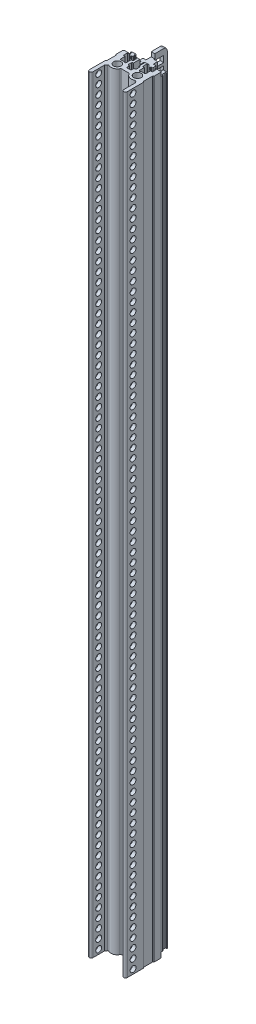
SolidWorks part; units mm, degrees
ref_plane "前视基准面" through (0, 0, 0) normal (0, 0, 1) x (1, 0, 0)
ref_plane "上视基准面" through (0, 0, 0) normal (0, 1, 0) x (1, 0, 0)
ref_plane "右视基准面" through (0, 0, 0) normal (1, 0, 0) x (0, 0, -1)
sketch "草图1" plane through (0, 0, 0) normal (0, 1, 0) x (1, 0, 0)
  line L0 (-2.825, 13.6) -> (-3.725, 13.6)
  line L1 (-8.025, 13.6) -> (-8.025, 11.3)
  line L2 (-3.725, 11.3) -> (-2.825, 11.3)
  line L3 (-3.725, 7.5298) -> (-3.725, 11.3)
  line L4 (-7.125, 11.3) -> (-7.125, 7.8763)
  line L5 (-8.025, 11.3) -> (-7.125, 11.3)
  line L6 (-2.825, 13.6) -> (-2.825, 11.3)
  line L7 (-7.125, 13.6) -> (-8.025, 13.6)
  line L8 (-7.125, 14.6) -> (-7.125, 13.6)
  line L9 (-8.025, 14.6) -> (-7.125, 14.6)
  line L10 (-8.025, 15.8) -> (-8.025, 14.6)
  line L11 (-7.125, 15.8) -> (-8.025, 15.8)
  line L12 (-5.675, 5.25) -> (5.675, 5.25) construction
  line L13 (0, 5.25) -> (0, 10.7319) construction
  line L15 (-10.275, 14.8) -> (-10.275, 13.75)
  line L16 (-9.525, 16.95) -> (-9.525, 15.2)
  line L17 (-10.275, 12.95) -> (-10.375, 12.95) construction
  line L18 (-10.675, 12.65) -> (-10.375, 12.95) construction
  line L19 (-10.675, 9.65) -> (-10.675, 12.65)
  line L20 (-10.2249, 9.1498) -> (-10.675, 9.65)
  line L21 (-10.2249, 9.1498) -> (-10.2251, 4.1498)
  line L22 (-10.675, 3.65) -> (-10.2251, 4.1498)
  line L23 (-10.675, -5.5) -> (-10.675, 3.65)
  line L24 (-8.675, -4.1) -> (-8.675, 0)
  line L25 (-0.675, 20.25) -> (-0.675, 17.75)
  line L26 (-2.075, 20.25) -> (-0.675, 20.25)
  line L27 (-2.075, 17.75) -> (-2.075, 20.25)
  line L28 (-3.725, 17.75) -> (-2.075, 17.75)
  line L29 (-3.725, 15.8) -> (-3.725, 17.75)
  line L30 (-2.825, 15.8) -> (-3.725, 15.8)
  line L31 (-2.825, 14.6) -> (-2.825, 15.8)
  line L32 (-3.725, 14.6) -> (-2.825, 14.6)
  line L33 (-3.725, 13.6) -> (-3.725, 14.6)
  line L34 (-10.675, -5.5) -> (-10.675, 3.65)
  line L35 (-8.675, -5.5) -> (-8.675, 0)
  line L36 (-0.675, 20.25) -> (-0.675, 17.75)
  line L37 (0.675, 20.25) -> (0.675, 17.75)
  line L38 (-2.075, 20.25) -> (-0.675, 20.25)
  line L39 (-2.075, 17.75) -> (-2.075, 20.25)
  line L40 (-3.725, 17.75) -> (-2.075, 17.75)
  line L41 (-3.725, 15.8) -> (-3.725, 17.75)
  line L42 (-2.825, 15.8) -> (-3.725, 15.8)
  line L43 (-2.825, 14.6) -> (-2.825, 15.8)
  line L44 (-3.725, 14.6) -> (-2.825, 14.6)
  line L45 (-3.725, 13.6) -> (-3.725, 14.6)
  line L46 (-2.825, 13.6) -> (-3.725, 13.6)
  line L47 (2.825, 13.6) -> (2.825, 11.3)
  line L48 (-3.725, 11.3) -> (-2.825, 11.3)
  line L49 (-3.725, 7.5298) -> (-3.725, 11.3)
  line L50 (-7.125, 11.3) -> (-7.125, 7.8763)
  line L51 (-8.025, 11.3) -> (-7.125, 11.3)
  line L52 (2.825, 11.3) -> (2.8554, 11.3157)
  line L53 (-7.125, 13.6) -> (-8.025, 13.6)
  line L54 (-7.125, 14.6) -> (-7.125, 13.6)
  line L55 (-8.025, 14.6) -> (-7.125, 14.6)
  line L56 (-8.025, 15.8) -> (-8.025, 14.6)
  line L57 (-7.125, 15.8) -> (-8.025, 15.8)
  line L58 (-10.275, 13.75) -> (-10.375, 13.75)
  line L59 (-9.725, 15) -> (-10.075, 15)
  line L60 (-7.875, 17.75) -> (-9.675, 17.75)
  line L61 (-9.675, 17.75) -> (-9.7164, 17.7086)
  line L62 (-10.225, 17.45) -> (-10.225, 17.35)
  line L63 (-10.275, 12.95) -> (-10.375, 12.95) construction
  line L64 (-10.675, 12.65) -> (-10.375, 12.95) construction
  line L65 (-10.675, 9.65) -> (-10.675, 12.65)
  line L66 (-10.2249, 9.1498) -> (-10.675, 9.65)
  line L67 (-10.2249, 9.1498) -> (-10.2251, 4.1498)
  line L68 (-10.2251, 4.1498) -> (-10.2251, 6.4588)
  line L69 (2.825, 13.6) -> (3.725, 13.6)
  line L70 (8.025, 13.6) -> (8.025, 11.3)
  line L71 (3.725, 11.3) -> (2.825, 11.3)
  line L72 (3.725, 7.5298) -> (3.725, 11.3)
  line L73 (7.125, 11.3) -> (7.125, 7.8763)
  line L74 (8.025, 11.3) -> (7.125, 11.3)
  line L75 (-10.025, 17.15) -> (-9.725, 17.15)
  line L76 (7.125, 13.6) -> (8.025, 13.6)
  line L77 (7.125, 14.6) -> (7.125, 13.6)
  line L78 (8.025, 14.6) -> (7.125, 14.6)
  line L79 (8.025, 15.8) -> (8.025, 14.6)
  line L80 (7.125, 15.8) -> (8.025, 15.8)
  line L81 (-9.8578, 17.65) -> (-10.025, 17.65)
  line L82 (-7.8336, 17.7086) -> (-7.875, 17.75)
  line L83 (-7.325, 17.35) -> (-7.325, 17.45)
  line L85 (7.125, 15.8) -> (7.125, 15.8672)
  line L86 (10.275, 12.95) -> (10.375, 12.95) construction
  line L87 (10.675, 12.65) -> (10.375, 12.95) construction
  line L88 (10.675, 9.65) -> (10.675, 12.65)
  line L89 (10.2249, 9.1498) -> (10.675, 9.65)
  line L90 (10.2249, 9.1498) -> (10.2251, 4.1498)
  line L91 (10.675, 3.65) -> (10.2251, 4.1498)
  line L92 (10.675, -5.5) -> (10.675, 3.65)
  line L93 (8.675, -4.1) -> (8.675, 0)
  line L94 (0.675, 20.25) -> (0.675, 17.75)
  line L95 (2.075, 20.25) -> (0.675, 20.25)
  line L96 (2.075, 17.75) -> (2.075, 20.25)
  line L97 (3.725, 17.75) -> (2.075, 17.75)
  line L98 (3.725, 15.8) -> (3.725, 17.75)
  line L99 (2.825, 15.8) -> (3.725, 15.8)
  line L100 (2.825, 14.6) -> (2.825, 15.8)
  line L101 (3.725, 14.6) -> (2.825, 14.6)
  line L102 (3.725, 13.6) -> (3.725, 14.6)
  line L103 (10.675, -5.5) -> (10.675, 3.65)
  line L104 (8.675, -5.5) -> (8.675, 0)
  line L105 (8.675, 0) -> (-8.675, 0)
  line L106 (0.675, 20.25) -> (0.675, 17.75)
  line L107 (2.075, 20.25) -> (0.675, 20.25)
  line L108 (2.075, 17.75) -> (2.075, 20.25)
  line L109 (3.725, 17.75) -> (2.075, 17.75)
  line L110 (3.725, 15.8) -> (3.725, 17.75)
  line L111 (2.825, 15.8) -> (3.725, 15.8)
  line L112 (2.825, 14.6) -> (2.825, 15.8)
  line L113 (3.725, 14.6) -> (2.825, 14.6)
  line L114 (3.725, 13.6) -> (3.725, 14.6)
  line L115 (2.825, 13.6) -> (3.725, 13.6)
  line L116 (7.1836, 16.0086) -> (7.7664, 16.5914)
  line L117 (3.725, 11.3) -> (2.825, 11.3)
  line L118 (3.725, 7.5298) -> (3.725, 11.3)
  line L119 (7.125, 11.3) -> (7.125, 7.8763)
  line L120 (8.025, 11.3) -> (7.125, 11.3)
  line L121 (7.825, 16.7328) -> (7.825, 16.95)
  line L122 (7.125, 13.6) -> (8.025, 13.6)
  line L123 (7.125, 14.6) -> (7.125, 13.6)
  line L124 (8.025, 14.6) -> (7.125, 14.6)
  line L125 (8.025, 15.8) -> (8.025, 14.6)
  line L126 (7.125, 15.8) -> (8.025, 15.8)
  line L127 (7.625, 17.15) -> (7.525, 17.15)
  line L128 (7.325, 17.35) -> (7.325, 17.45)
  line L129 (7.525, 17.65) -> (7.6922, 17.65)
  line L130 (7.8336, 17.7086) -> (7.875, 17.75)
  line L131 (9.725, 15) -> (10.075, 15)
  line L132 (10.275, 12.95) -> (10.375, 12.95) construction
  line L133 (10.675, 12.65) -> (10.375, 12.95) construction
  line L134 (10.675, 9.65) -> (10.675, 12.65)
  line L135 (10.2249, 9.1498) -> (10.675, 9.65)
  line L136 (10.2249, 9.1498) -> (10.2251, 4.1498)
  line L137 (10.2251, 4.1498) -> (10.2251, 6.4588)
  line L138 (-0.675, 17.75) -> (0.675, 17.75)
  line L139 (-7.125, 16.775) -> (-3.725, 16.775) construction
  line L140 (-5.425, 16.775) -> (-5.425, 11.3) construction
  line L141 (3.725, 16.775) -> (7.125, 16.775) construction
  line L142 (5.425, 16.775) -> (5.425, 12.65) construction
  line L143 (9.8578, 17.65) -> (10.025, 17.65)
  line L144 (10.025, 17.15) -> (9.725, 17.15)
  line L145 (10.225, 17.45) -> (10.225, 17.35)
  line L146 (9.675, 17.75) -> (9.7164, 17.7086)
  line L147 (9.525, 16.95) -> (9.525, 15.2)
  line L148 (7.875, 17.75) -> (9.675, 17.75)
  line L149 (10.275, 14.8) -> (10.275, 13.75)
  line L150 (-7.825, 16.7328) -> (-7.825, 16.95)
  line L151 (-7.125, 15.8) -> (-7.125, 15.8672)
  line L152 (-7.525, 17.65) -> (-7.6922, 17.65)
  line L153 (-7.625, 17.15) -> (-7.525, 17.15)
  line L154 (-7.1836, 16.0086) -> (-7.7664, 16.5914)
  line L155 (-10.375, 13.75) -> (-10.675, 13.45)
  line L156 (-10.675, 13.45) -> (-10.675, 12.65)
  line L157 (10.675, 13.45) -> (10.675, 12.65)
  line L158 (10.375, 13.75) -> (10.675, 13.45)
  line L159 (10.275, 13.75) -> (10.375, 13.75)
  arc A1 (-10.675, -5.5) -> (-8.675, -5.5) centre (-9.675, -5.5) ccw
  arc A2 (-10.675, -5.5) -> (-8.675, -5.5) centre (-9.675, -5.5) ccw
  circle A4 centre (-5.675, 5.25) radius 1.6
  arc A6 (8.675, -5.5) -> (10.675, -5.5) centre (9.675, -5.5) ccw
  arc A7 (8.675, -5.5) -> (10.675, -5.5) centre (9.675, -5.5) ccw
  circle A9 centre (5.675, 5.25) radius 1.6
  arc A10 (7.1836, 16.0086) -> (7.125, 15.8672) centre (7.325, 15.8672) ccw
  arc A11 (7.7664, 16.5914) -> (7.825, 16.7328) centre (7.625, 16.7328) ccw
  arc A12 (7.825, 16.95) -> (7.625, 17.15) centre (7.625, 16.95) ccw
  arc A13 (7.325, 17.35) -> (7.525, 17.15) centre (7.525, 17.35) ccw
  arc A14 (7.525, 17.65) -> (7.325, 17.45) centre (7.525, 17.45) ccw
  arc A15 (10.275, 14.8) -> (10.075, 15) centre (10.075, 14.8) ccw
  arc A16 (10.225, 17.45) -> (10.025, 17.65) centre (10.025, 17.45) ccw
  arc A17 (9.725, 17.15) -> (9.525, 16.95) centre (9.725, 16.95) ccw
  arc A18 (10.025, 17.15) -> (10.225, 17.35) centre (10.025, 17.35) ccw
  arc A19 (9.7164, 17.7086) -> (9.8578, 17.65) centre (9.8578, 17.85) ccw
  arc A20 (9.525, 15.2) -> (9.725, 15) centre (9.725, 15.2) ccw
  arc A21 (7.6922, 17.65) -> (7.8336, 17.7086) centre (7.6922, 17.85) ccw
  arc A22 (-9.525, 15.2) -> (-9.725, 15) centre (-9.725, 15.2) cw
  arc A23 (-10.275, 14.8) -> (-10.075, 15) centre (-10.075, 14.8) cw
  arc A24 (-9.7164, 17.7086) -> (-9.8578, 17.65) centre (-9.8578, 17.85) cw
  arc A25 (-10.025, 17.15) -> (-10.225, 17.35) centre (-10.025, 17.35) cw
  arc A26 (-9.725, 17.15) -> (-9.525, 16.95) centre (-9.725, 16.95) cw
  arc A27 (-10.225, 17.45) -> (-10.025, 17.65) centre (-10.025, 17.45) cw
  arc A28 (-7.7664, 16.5914) -> (-7.825, 16.7328) centre (-7.625, 16.7328) cw
  arc A29 (-7.1836, 16.0086) -> (-7.125, 15.8672) centre (-7.325, 15.8672) cw
  arc A30 (-7.6922, 17.65) -> (-7.8336, 17.7086) centre (-7.6922, 17.85) cw
  arc A31 (-7.525, 17.65) -> (-7.325, 17.45) centre (-7.525, 17.45) cw
  arc A32 (-7.325, 17.35) -> (-7.525, 17.15) centre (-7.525, 17.35) cw
  arc A33 (-7.825, 16.95) -> (-7.625, 17.15) centre (-7.625, 16.95) cw
  arc A34 (-3.725, 7.5298) -> (-7.125, 7.8763) centre (-5.675, 5.25) ccw
  arc A35 (7.125, 7.8763) -> (3.725, 7.5298) centre (5.675, 5.25) ccw
  dimension "D4" = 11.35
  dimension "D5" = 3.2
  dimension "D6" = 6
  dimension "D7" = 0.1
  dimension "D1" = 5.2
  dimension "D2" = 5.2
  dimension "D3" = 15
  dimension "D8" = 0.8
extrude "凸台-拉伸1" add sketch "草图1" along normal mid plane 431.8
sketch "草图4" plane through (0, 215.9, 0) normal (0, 1, 0) x (1, 0, 0)
  line L1 (-2.075, 17.75) -> (-0.075, 17.75)
  line L2 (-2.075, 17.75) -> (-2.075, 27.75)
  line L3 (-2.075, 27.75) -> (-0.075, 27.75)
  line L4 (-0.075, 17.75) -> (-0.075, 27.75)
  dimension "D1" = 2
  dimension "D2" = 10
extrude "凸台-拉伸2" add sketch "草图4" against normal up to surface (431.8 mm away)
sketch "草图17" plane through (0, 215.9, 0) normal (0, 1, 0) x (1, 0, 0)
  line L0 (7.125, 13.6) -> (8.025, 13.6) construction
  line L1 (8.125, 13.6) -> (2.725, 13.6)
  line L2 (8.125, 13.6) -> (8.125, 11.1)
  line L3 (8.125, 11.1) -> (2.725, 11.1)
  line L4 (2.725, 13.6) -> (2.725, 11.1)
  line L5 (7.125, 15.8) -> (8.025, 15.8) construction
  line L6 (8.125, 15.8) -> (2.725, 15.8)
  line L7 (8.125, 15.8) -> (8.125, 14.6)
  line L8 (8.125, 14.6) -> (2.725, 14.6)
  line L9 (2.725, 15.8) -> (2.725, 14.6)
  line L10 (3.725, 14.6) -> (2.825, 14.6) construction
  line L11 (-2.825, 15.8) -> (-3.725, 15.8) construction
  line L12 (-2.725, 15.8) -> (-8.125, 15.8)
  line L13 (-2.725, 15.8) -> (-2.725, 14.6)
  line L14 (-2.725, 14.6) -> (-8.125, 14.6)
  line L15 (-8.125, 15.8) -> (-8.125, 14.6)
  line L16 (-8.025, 14.6) -> (-7.125, 14.6) construction
  line L17 (-2.825, 13.6) -> (-3.725, 13.6) construction
  line L18 (-2.725, 13.6) -> (-8.125, 13.6)
  line L19 (-2.725, 13.6) -> (-2.725, 11.1)
  line L20 (-2.725, 11.1) -> (-8.125, 11.1)
  line L21 (-8.125, 13.6) -> (-8.125, 11.1)
  line L22 (8.025, 13.6) -> (8.025, 11.3) construction
  line L23 (2.825, 13.6) -> (2.825, 11.3) construction
  line L24 (3.725, 11.3) -> (2.825, 11.3) construction
  line L25 (-2.825, 13.6) -> (-2.825, 11.3) construction
  line L26 (-8.025, 13.6) -> (-8.025, 11.3) construction
  dimension "D1" = 0.1
  dimension "D2" = 0.1
  dimension "D3" = 0.2
  dimension "D4" = 0.1
  dimension "D5" = 0.1
extrude "切除-拉伸10" cut sketch "草图17" against normal through all
fillet "圆角4" radius 0.2 16 edges at (8.125, 0, -11.1) (8.125, 0, -14.6) (8.125, 0, -13.6) (8.125, 0, -15.8) (2.725, 0, -15.8) (2.725, 0, -13.6) (2.725, 0, -11.1) (2.725, 0, -14.6) (-8.125, 0, -11.1) (-8.125, 0, -14.6) (-8.125, 0, -13.6) (-8.125, 0, -15.8) (-2.725, 0, -11.1) (-2.725, 0, -14.6) (-2.725, 0, -13.6) (-2.725, 0, -15.8)
sketch "草图14" plane through (0, 215.9, 0) normal (0, 1, 0) x (1, 0, 0)
  line L0 (-0.075, 17.75) -> (-0.575, 17.75)
  line L1 (-0.575, 17.75) -> (-0.575, 19.25)
  line L2 (-0.575, 19.25) -> (-0.075, 19.75)
  line L3 (-0.075, 17.75) -> (-0.075, 27.75) construction
  line L4 (-0.075, 19.75) -> (-0.075, 17.75)
  line L5 (0.675, 20.25) -> (1.675, 20.25)
  line L6 (2.075, 20.25) -> (0.675, 20.25) construction
  line L7 (1.675, 20.25) -> (0.675, 19.25)
  line L8 (0.675, 20.25) -> (0.675, 17.75) construction
  line L9 (0.675, 19.25) -> (0.675, 20.25)
  dimension "D1" = 45
  dimension "D2" = 0.5
  dimension "D3" = 0.5
  dimension "D4" = 1
  dimension "D5" = 1
extrude "切除-拉伸7" cut sketch "草图14" against normal through all
sketch "草图19" plane through (0, 215.9, 0) normal (0, 1, 0) x (1, 0, 0)
  line L1 (2.075, 20.25) -> (-0.575, 20.25)
  line L2 (2.075, 20.25) -> (2.075, 17.75)
  line L3 (2.075, 17.75) -> (-0.575, 17.75)
  line L4 (-0.575, 20.25) -> (-0.575, 17.75)
extrude "凸台-拉伸3" add sketch "草图19" against normal up to surface (431.8 mm away)
sketch "草图6" plane through (0, -215.9, 0) normal (0, -1, 0) x (-1, 0, 0)
  line L0 (0, 0) -> (0, 12.9416) construction
  line L1 (8.675, 0) -> (8.675, 1)
  line L2 (-7.6934, 2.3906) -> (-8.675, 1)
  line L3 (7.6934, 2.3906) -> (8.675, 1)
  line L4 (-8.675, 0) -> (-8.675, 1)
  line L5 (-3.725, 17.75) -> (-2.075, 17.75) construction
  line L7 (2.25, 7.75) -> (2.25, 10.25)
  line L8 (8.675, 0) -> (-8.675, 0)
  line L9 (8.675, -5.5) -> (8.675, 0) construction
  line L10 (-2.4058, 4) -> (2.4058, 4)
  line L11 (2.25, 10.25) -> (1.5, 10.25)
  line L12 (1.5, 10.25) -> (1.5, 16.25)
  line L13 (-1.5, 10.25) -> (-1.5, 16.25)
  line L14 (-2.25, 10.25) -> (-1.5, 10.25)
  line L15 (-2.25, 7.75) -> (-2.25, 10.25)
  line L16 (2.25, 7.75) -> (1.25, 7.75)
  line L17 (1.25, 7.75) -> (1.25, 6)
  line L18 (-1.25, 7.75) -> (-1.25, 6)
  line L19 (-2.25, 7.75) -> (-1.25, 7.75)
  line L20 (1.25, 6) -> (-1.25, 6)
  line L21 (1.5, 16.25) -> (-1.5, 16.25)
  arc A0 (2.4058, 4) -> (7.6934, 2.3906) centre (5.675, 5.25) ccw
  arc A1 (-2.4058, 4) -> (-7.6934, 2.3906) centre (-5.675, 5.25) cw
  dimension "D1" = 7
  dimension "D3" = 4
  dimension "D2" = 1
  dimension "D4" = 1.5
  dimension "D6" = 2
  dimension "D7" = 2.5
  dimension "D8" = 3
  dimension "D9" = 4.5
  dimension "D10" = 6
  dimension "D11" = 2.5
extrude "切除-拉伸4" cut sketch "草图6" against normal through all
sketch "草图2" plane through (10.675, 0, 0) normal (1, 0, 0) x (0, 0, -1)
  line L0 (20.25, 0) -> (52.8609, 0) construction
  line L1 (20.75, 215.9) -> (13.75, 215.9)
  line L2 (20.75, 215.9) -> (20.75, 213.36)
  line L3 (20.75, 213.36) -> (13.75, 213.36)
  line L4 (13.75, 215.9) -> (13.75, 213.36)
  line L5 (20.25, 215.9) -> (20.25, -215.9) construction
  line L6 (13.75, -215.9) -> (13.75, -213.36)
  line L7 (20.75, -213.36) -> (13.75, -213.36)
  line L8 (20.75, -215.9) -> (20.75, -213.36)
  line L9 (20.75, -215.9) -> (13.75, -215.9)
  line L11 (17.75, 215.9) -> (27.75, 215.9) construction
  line L12 (27.75, -215.9) -> (27.75, 215.9) construction
  dimension "D1" = 7
  dimension "D2" = 2.54
  dimension "D3" = 7
extrude "切除-拉伸1" cut sketch "草图2" against normal through all
sketch "草图3" plane through (10.675, 0, 0) normal (1, 0, 0) x (0, 0, -1)
  line L0 (-6.5, 215.9) -> (-6.5, -215.9) construction
  line L1 (-5.5, 215.9) -> (3.65, 215.9) construction
  circle A0 centre (-2.25, 213.36) radius 1.65
  circle A1 centre (-2.25, 208.28) radius 1.65
  circle A2 centre (-2.25, 203.2) radius 1.65
  circle A3 centre (-2.25, 198.12) radius 1.65
  circle A4 centre (-2.25, 193.04) radius 1.65
  circle A5 centre (-2.25, 187.96) radius 1.65
  circle A6 centre (-2.25, 182.88) radius 1.65
  circle A7 centre (-2.25, 177.8) radius 1.65
  circle A8 centre (-2.25, 172.72) radius 1.65
  circle A9 centre (-2.25, 167.64) radius 1.65
  circle A10 centre (-2.25, 162.56) radius 1.65
  circle A11 centre (-2.25, 157.48) radius 1.65
  circle A12 centre (-2.25, 152.4) radius 1.65
  circle A13 centre (-2.25, 147.32) radius 1.65
  circle A14 centre (-2.25, 142.24) radius 1.65
  circle A15 centre (-2.25, 137.16) radius 1.65
  circle A16 centre (-2.25, 132.08) radius 1.65
  circle A17 centre (-2.25, 127) radius 1.65
  circle A18 centre (-2.25, 121.92) radius 1.65
  circle A19 centre (-2.25, 116.84) radius 1.65
  circle A20 centre (-2.25, 111.76) radius 1.65
  circle A21 centre (-2.25, 106.68) radius 1.65
  circle A22 centre (-2.25, 101.6) radius 1.65
  circle A23 centre (-2.25, 96.52) radius 1.65
  circle A24 centre (-2.25, 91.44) radius 1.65
  circle A25 centre (-2.25, 86.36) radius 1.65
  circle A26 centre (-2.25, 81.28) radius 1.65
  circle A27 centre (-2.25, 76.2) radius 1.65
  circle A28 centre (-2.25, 71.12) radius 1.65
  circle A29 centre (-2.25, 66.04) radius 1.65
  circle A30 centre (-2.25, 60.96) radius 1.65
  circle A31 centre (-2.25, 55.88) radius 1.65
  circle A32 centre (-2.25, 50.8) radius 1.65
  circle A33 centre (-2.25, 45.72) radius 1.65
  circle A34 centre (-2.25, 40.64) radius 1.65
  circle A35 centre (-2.25, 35.56) radius 1.65
  circle A36 centre (-2.25, 30.48) radius 1.65
  circle A37 centre (-2.25, 25.4) radius 1.65
  circle A38 centre (-2.25, 20.32) radius 1.65
  circle A39 centre (-2.25, 15.24) radius 1.65
  circle A40 centre (-2.25, 10.16) radius 1.65
  circle A41 centre (-2.25, 5.08) radius 1.65
  circle A42 centre (-2.25, 0) radius 1.65
  circle A43 centre (-2.25, -5.08) radius 1.65
  circle A44 centre (-2.25, -10.16) radius 1.65
  circle A45 centre (-2.25, -15.24) radius 1.65
  circle A46 centre (-2.25, -20.32) radius 1.65
  circle A47 centre (-2.25, -25.4) radius 1.65
  circle A48 centre (-2.25, -30.48) radius 1.65
  circle A49 centre (-2.25, -35.56) radius 1.65
  circle A50 centre (-2.25, -40.64) radius 1.65
  circle A51 centre (-2.25, -45.72) radius 1.65
  circle A52 centre (-2.25, -50.8) radius 1.65
  circle A53 centre (-2.25, -55.88) radius 1.65
  circle A54 centre (-2.25, -60.96) radius 1.65
  circle A55 centre (-2.25, -66.04) radius 1.65
  circle A56 centre (-2.25, -71.12) radius 1.65
  circle A57 centre (-2.25, -76.2) radius 1.65
  circle A58 centre (-2.25, -81.28) radius 1.65
  circle A59 centre (-2.25, -86.36) radius 1.65
  circle A60 centre (-2.25, -91.44) radius 1.65
  circle A61 centre (-2.25, -96.52) radius 1.65
  circle A62 centre (-2.25, -101.6) radius 1.65
  circle A63 centre (-2.25, -106.68) radius 1.65
  circle A64 centre (-2.25, -111.76) radius 1.65
  circle A65 centre (-2.25, -116.84) radius 1.65
  circle A66 centre (-2.25, -121.92) radius 1.65
  circle A67 centre (-2.25, -127) radius 1.65
  circle A68 centre (-2.25, -132.08) radius 1.65
  circle A69 centre (-2.25, -137.16) radius 1.65
  circle A70 centre (-2.25, -142.24) radius 1.65
  circle A71 centre (-2.25, -147.32) radius 1.65
  circle A72 centre (-2.25, -152.4) radius 1.65
  circle A73 centre (-2.25, -157.48) radius 1.65
  circle A74 centre (-2.25, -162.56) radius 1.65
  circle A75 centre (-2.25, -167.64) radius 1.65
  circle A76 centre (-2.25, -172.72) radius 1.65
  circle A77 centre (-2.25, -177.8) radius 1.65
  circle A78 centre (-2.25, -182.88) radius 1.65
  circle A79 centre (-2.25, -187.96) radius 1.65
  circle A80 centre (-2.25, -193.04) radius 1.65
  circle A81 centre (-2.25, -198.12) radius 1.65
  circle A82 centre (-2.25, -203.2) radius 1.65
  circle A83 centre (-2.25, -208.28) radius 1.65
  circle A84 centre (-2.25, -213.36) radius 1.65
  dimension "D1" = 4.25
  dimension "D3" = 3.3
  dimension "D2" = 2.54
  dimension "D4" = 85
extrude "切除-拉伸2" cut sketch "草图3" against normal through all
sketch "草图5" plane through (-2.075, 0, 0) normal (-1, 0, 0) x (0, 0, 1)
  line L0 (-27.75, -215.9) -> (-27.75, 215.9) construction
  line L1 (-25.75, -209.02) -> (-20.25, -209.02)
  line L2 (-25.75, -209.02) -> (-25.75, -212.62)
  line L3 (-25.75, -212.62) -> (-20.25, -212.62)
  line L4 (-20.25, -209.02) -> (-20.25, -212.62)
  line L5 (-20.75, -215.9) -> (-27.75, -215.9) construction
  line L6 (-25.75, -203.94) -> (-20.25, -203.94)
  line L7 (-25.75, -203.94) -> (-25.75, -207.54)
  line L8 (-25.75, -207.54) -> (-20.25, -207.54)
  line L9 (-20.25, -203.94) -> (-20.25, -207.54)
  line L10 (-25.75, -198.86) -> (-20.25, -198.86)
  line L11 (-25.75, -198.86) -> (-25.75, -202.46)
  line L12 (-25.75, -202.46) -> (-20.25, -202.46)
  line L13 (-20.25, -198.86) -> (-20.25, -202.46)
  line L14 (-25.75, -193.78) -> (-20.25, -193.78)
  line L15 (-25.75, -193.78) -> (-25.75, -197.38)
  line L16 (-25.75, -197.38) -> (-20.25, -197.38)
  line L17 (-20.25, -193.78) -> (-20.25, -197.38)
  line L18 (-25.75, -188.7) -> (-20.25, -188.7)
  line L19 (-25.75, -188.7) -> (-25.75, -192.3)
  line L20 (-25.75, -192.3) -> (-20.25, -192.3)
  line L21 (-20.25, -188.7) -> (-20.25, -192.3)
  line L22 (-25.75, -183.62) -> (-20.25, -183.62)
  line L23 (-25.75, -183.62) -> (-25.75, -187.22)
  line L24 (-25.75, -187.22) -> (-20.25, -187.22)
  line L25 (-20.25, -183.62) -> (-20.25, -187.22)
  line L26 (-25.75, -178.54) -> (-20.25, -178.54)
  line L27 (-25.75, -178.54) -> (-25.75, -182.14)
  line L28 (-25.75, -182.14) -> (-20.25, -182.14)
  line L29 (-20.25, -178.54) -> (-20.25, -182.14)
  line L30 (-25.75, -173.46) -> (-20.25, -173.46)
  line L31 (-25.75, -173.46) -> (-25.75, -177.06)
  line L32 (-25.75, -177.06) -> (-20.25, -177.06)
  line L33 (-20.25, -173.46) -> (-20.25, -177.06)
  line L34 (-25.75, -168.38) -> (-20.25, -168.38)
  line L35 (-25.75, -168.38) -> (-25.75, -171.98)
  line L36 (-25.75, -171.98) -> (-20.25, -171.98)
  line L37 (-20.25, -168.38) -> (-20.25, -171.98)
  line L38 (-25.75, -163.3) -> (-20.25, -163.3)
  line L39 (-25.75, -163.3) -> (-25.75, -166.9)
  line L40 (-25.75, -166.9) -> (-20.25, -166.9)
  line L41 (-20.25, -163.3) -> (-20.25, -166.9)
  line L42 (-25.75, -158.22) -> (-20.25, -158.22)
  line L43 (-25.75, -158.22) -> (-25.75, -161.82)
  line L44 (-25.75, -161.82) -> (-20.25, -161.82)
  line L45 (-20.25, -158.22) -> (-20.25, -161.82)
  line L46 (-25.75, -153.14) -> (-20.25, -153.14)
  line L47 (-25.75, -153.14) -> (-25.75, -156.74)
  line L48 (-25.75, -156.74) -> (-20.25, -156.74)
  line L49 (-20.25, -153.14) -> (-20.25, -156.74)
  line L50 (-25.75, -148.06) -> (-20.25, -148.06)
  line L51 (-25.75, -148.06) -> (-25.75, -151.66)
  line L52 (-25.75, -151.66) -> (-20.25, -151.66)
  line L53 (-20.25, -148.06) -> (-20.25, -151.66)
  line L54 (-25.75, -142.98) -> (-20.25, -142.98)
  line L55 (-25.75, -142.98) -> (-25.75, -146.58)
  line L56 (-25.75, -146.58) -> (-20.25, -146.58)
  line L57 (-20.25, -142.98) -> (-20.25, -146.58)
  line L58 (-25.75, -137.9) -> (-20.25, -137.9)
  line L59 (-25.75, -137.9) -> (-25.75, -141.5)
  line L60 (-25.75, -141.5) -> (-20.25, -141.5)
  line L61 (-20.25, -137.9) -> (-20.25, -141.5)
  line L62 (-25.75, -132.82) -> (-20.25, -132.82)
  line L63 (-25.75, -132.82) -> (-25.75, -136.42)
  line L64 (-25.75, -136.42) -> (-20.25, -136.42)
  line L65 (-20.25, -132.82) -> (-20.25, -136.42)
  line L66 (-25.75, -127.74) -> (-20.25, -127.74)
  line L67 (-25.75, -127.74) -> (-25.75, -131.34)
  line L68 (-25.75, -131.34) -> (-20.25, -131.34)
  line L69 (-20.25, -127.74) -> (-20.25, -131.34)
  line L70 (-25.75, -122.66) -> (-20.25, -122.66)
  line L71 (-25.75, -122.66) -> (-25.75, -126.26)
  line L72 (-25.75, -126.26) -> (-20.25, -126.26)
  line L73 (-20.25, -122.66) -> (-20.25, -126.26)
  line L74 (-25.75, -117.58) -> (-20.25, -117.58)
  line L75 (-25.75, -117.58) -> (-25.75, -121.18)
  line L76 (-25.75, -121.18) -> (-20.25, -121.18)
  line L77 (-20.25, -117.58) -> (-20.25, -121.18)
  line L78 (-25.75, -112.5) -> (-20.25, -112.5)
  line L79 (-25.75, -112.5) -> (-25.75, -116.1)
  line L80 (-25.75, -116.1) -> (-20.25, -116.1)
  line L81 (-20.25, -112.5) -> (-20.25, -116.1)
  line L82 (-25.75, -107.42) -> (-20.25, -107.42)
  line L83 (-25.75, -107.42) -> (-25.75, -111.02)
  line L84 (-25.75, -111.02) -> (-20.25, -111.02)
  line L85 (-20.25, -107.42) -> (-20.25, -111.02)
  line L86 (-25.75, -102.34) -> (-20.25, -102.34)
  line L87 (-25.75, -102.34) -> (-25.75, -105.94)
  line L88 (-25.75, -105.94) -> (-20.25, -105.94)
  line L89 (-20.25, -102.34) -> (-20.25, -105.94)
  line L90 (-25.75, -97.26) -> (-20.25, -97.26)
  line L91 (-25.75, -97.26) -> (-25.75, -100.86)
  line L92 (-25.75, -100.86) -> (-20.25, -100.86)
  line L93 (-20.25, -97.26) -> (-20.25, -100.86)
  line L94 (-25.75, -92.18) -> (-20.25, -92.18)
  line L95 (-25.75, -92.18) -> (-25.75, -95.78)
  line L96 (-25.75, -95.78) -> (-20.25, -95.78)
  line L97 (-20.25, -92.18) -> (-20.25, -95.78)
  line L98 (-25.75, -87.1) -> (-20.25, -87.1)
  line L99 (-25.75, -87.1) -> (-25.75, -90.7)
  line L100 (-25.75, -90.7) -> (-20.25, -90.7)
  line L101 (-20.25, -87.1) -> (-20.25, -90.7)
  line L102 (-25.75, -82.02) -> (-20.25, -82.02)
  line L103 (-25.75, -82.02) -> (-25.75, -85.62)
  line L104 (-25.75, -85.62) -> (-20.25, -85.62)
  line L105 (-20.25, -82.02) -> (-20.25, -85.62)
  line L106 (-25.75, -76.94) -> (-20.25, -76.94)
  line L107 (-25.75, -76.94) -> (-25.75, -80.54)
  line L108 (-25.75, -80.54) -> (-20.25, -80.54)
  line L109 (-20.25, -76.94) -> (-20.25, -80.54)
  line L110 (-25.75, -71.86) -> (-20.25, -71.86)
  line L111 (-25.75, -71.86) -> (-25.75, -75.46)
  line L112 (-25.75, -75.46) -> (-20.25, -75.46)
  line L113 (-20.25, -71.86) -> (-20.25, -75.46)
  line L114 (-25.75, -66.78) -> (-20.25, -66.78)
  line L115 (-25.75, -66.78) -> (-25.75, -70.38)
  line L116 (-25.75, -70.38) -> (-20.25, -70.38)
  line L117 (-20.25, -66.78) -> (-20.25, -70.38)
  line L118 (-25.75, -61.7) -> (-20.25, -61.7)
  line L119 (-25.75, -61.7) -> (-25.75, -65.3)
  line L120 (-25.75, -65.3) -> (-20.25, -65.3)
  line L121 (-20.25, -61.7) -> (-20.25, -65.3)
  line L122 (-25.75, -56.62) -> (-20.25, -56.62)
  line L123 (-25.75, -56.62) -> (-25.75, -60.22)
  line L124 (-25.75, -60.22) -> (-20.25, -60.22)
  line L125 (-20.25, -56.62) -> (-20.25, -60.22)
  line L126 (-25.75, -51.54) -> (-20.25, -51.54)
  line L127 (-25.75, -51.54) -> (-25.75, -55.14)
  line L128 (-25.75, -55.14) -> (-20.25, -55.14)
  line L129 (-20.25, -51.54) -> (-20.25, -55.14)
  line L130 (-25.75, -46.46) -> (-20.25, -46.46)
  line L131 (-25.75, -46.46) -> (-25.75, -50.06)
  line L132 (-25.75, -50.06) -> (-20.25, -50.06)
  line L133 (-20.25, -46.46) -> (-20.25, -50.06)
  line L134 (-25.75, -41.38) -> (-20.25, -41.38)
  line L135 (-25.75, -41.38) -> (-25.75, -44.98)
  line L136 (-25.75, -44.98) -> (-20.25, -44.98)
  line L137 (-20.25, -41.38) -> (-20.25, -44.98)
  line L138 (-25.75, -36.3) -> (-20.25, -36.3)
  line L139 (-25.75, -36.3) -> (-25.75, -39.9)
  line L140 (-25.75, -39.9) -> (-20.25, -39.9)
  line L141 (-20.25, -36.3) -> (-20.25, -39.9)
  line L142 (-25.75, -31.22) -> (-20.25, -31.22)
  line L143 (-25.75, -31.22) -> (-25.75, -34.82)
  line L144 (-25.75, -34.82) -> (-20.25, -34.82)
  line L145 (-20.25, -31.22) -> (-20.25, -34.82)
  line L146 (-25.75, -26.14) -> (-20.25, -26.14)
  line L147 (-25.75, -26.14) -> (-25.75, -29.74)
  line L148 (-25.75, -29.74) -> (-20.25, -29.74)
  line L149 (-20.25, -26.14) -> (-20.25, -29.74)
  line L150 (-25.75, -21.06) -> (-20.25, -21.06)
  line L151 (-25.75, -21.06) -> (-25.75, -24.66)
  line L152 (-25.75, -24.66) -> (-20.25, -24.66)
  line L153 (-20.25, -21.06) -> (-20.25, -24.66)
  line L154 (-25.75, -15.98) -> (-20.25, -15.98)
  line L155 (-25.75, -15.98) -> (-25.75, -19.58)
  line L156 (-25.75, -19.58) -> (-20.25, -19.58)
  line L157 (-20.25, -15.98) -> (-20.25, -19.58)
  line L158 (-25.75, -10.9) -> (-20.25, -10.9)
  line L159 (-25.75, -10.9) -> (-25.75, -14.5)
  line L160 (-25.75, -14.5) -> (-20.25, -14.5)
  line L161 (-20.25, -10.9) -> (-20.25, -14.5)
  line L162 (-25.75, -5.82) -> (-20.25, -5.82)
  line L163 (-25.75, -5.82) -> (-25.75, -9.42)
  line L164 (-25.75, -9.42) -> (-20.25, -9.42)
  line L165 (-20.25, -5.82) -> (-20.25, -9.42)
  line L166 (-25.75, -0.74) -> (-20.25, -0.74)
  line L167 (-25.75, -0.74) -> (-25.75, -4.34)
  line L168 (-25.75, -4.34) -> (-20.25, -4.34)
  line L169 (-20.25, -0.74) -> (-20.25, -4.34)
  line L170 (-25.75, 4.34) -> (-20.25, 4.34)
  line L171 (-25.75, 4.34) -> (-25.75, 0.74)
  line L172 (-25.75, 0.74) -> (-20.25, 0.74)
  line L173 (-20.25, 4.34) -> (-20.25, 0.74)
  line L174 (-25.75, 9.42) -> (-20.25, 9.42)
  line L175 (-25.75, 9.42) -> (-25.75, 5.82)
  line L176 (-25.75, 5.82) -> (-20.25, 5.82)
  line L177 (-20.25, 9.42) -> (-20.25, 5.82)
  line L178 (-25.75, 14.5) -> (-20.25, 14.5)
  line L179 (-25.75, 14.5) -> (-25.75, 10.9)
  line L180 (-25.75, 10.9) -> (-20.25, 10.9)
  line L181 (-20.25, 14.5) -> (-20.25, 10.9)
  line L182 (-25.75, 19.58) -> (-20.25, 19.58)
  line L183 (-25.75, 19.58) -> (-25.75, 15.98)
  line L184 (-25.75, 15.98) -> (-20.25, 15.98)
  line L185 (-20.25, 19.58) -> (-20.25, 15.98)
  line L186 (-25.75, 24.66) -> (-20.25, 24.66)
  line L187 (-25.75, 24.66) -> (-25.75, 21.06)
  line L188 (-25.75, 21.06) -> (-20.25, 21.06)
  line L189 (-20.25, 24.66) -> (-20.25, 21.06)
  line L190 (-25.75, 29.74) -> (-20.25, 29.74)
  line L191 (-25.75, 29.74) -> (-25.75, 26.14)
  line L192 (-25.75, 26.14) -> (-20.25, 26.14)
  line L193 (-20.25, 29.74) -> (-20.25, 26.14)
  line L194 (-25.75, 34.82) -> (-20.25, 34.82)
  line L195 (-25.75, 34.82) -> (-25.75, 31.22)
  line L196 (-25.75, 31.22) -> (-20.25, 31.22)
  line L197 (-20.25, 34.82) -> (-20.25, 31.22)
  line L198 (-25.75, 39.9) -> (-20.25, 39.9)
  line L199 (-25.75, 39.9) -> (-25.75, 36.3)
  line L200 (-25.75, 36.3) -> (-20.25, 36.3)
  line L201 (-20.25, 39.9) -> (-20.25, 36.3)
  line L202 (-25.75, 44.98) -> (-20.25, 44.98)
  line L203 (-25.75, 44.98) -> (-25.75, 41.38)
  line L204 (-25.75, 41.38) -> (-20.25, 41.38)
  line L205 (-20.25, 44.98) -> (-20.25, 41.38)
  line L206 (-25.75, 50.06) -> (-20.25, 50.06)
  line L207 (-25.75, 50.06) -> (-25.75, 46.46)
  line L208 (-25.75, 46.46) -> (-20.25, 46.46)
  line L209 (-20.25, 50.06) -> (-20.25, 46.46)
  line L210 (-25.75, 55.14) -> (-20.25, 55.14)
  line L211 (-25.75, 55.14) -> (-25.75, 51.54)
  line L212 (-25.75, 51.54) -> (-20.25, 51.54)
  line L213 (-20.25, 55.14) -> (-20.25, 51.54)
  line L214 (-25.75, 60.22) -> (-20.25, 60.22)
  line L215 (-25.75, 60.22) -> (-25.75, 56.62)
  line L216 (-25.75, 56.62) -> (-20.25, 56.62)
  line L217 (-20.25, 60.22) -> (-20.25, 56.62)
  line L218 (-25.75, 65.3) -> (-20.25, 65.3)
  line L219 (-25.75, 65.3) -> (-25.75, 61.7)
  line L220 (-25.75, 61.7) -> (-20.25, 61.7)
  line L221 (-20.25, 65.3) -> (-20.25, 61.7)
  line L222 (-25.75, 70.38) -> (-20.25, 70.38)
  line L223 (-25.75, 70.38) -> (-25.75, 66.78)
  line L224 (-25.75, 66.78) -> (-20.25, 66.78)
  line L225 (-20.25, 70.38) -> (-20.25, 66.78)
  line L226 (-25.75, 75.46) -> (-20.25, 75.46)
  line L227 (-25.75, 75.46) -> (-25.75, 71.86)
  line L228 (-25.75, 71.86) -> (-20.25, 71.86)
  line L229 (-20.25, 75.46) -> (-20.25, 71.86)
  line L230 (-25.75, 80.54) -> (-20.25, 80.54)
  line L231 (-25.75, 80.54) -> (-25.75, 76.94)
  line L232 (-25.75, 76.94) -> (-20.25, 76.94)
  line L233 (-20.25, 80.54) -> (-20.25, 76.94)
  line L234 (-25.75, 85.62) -> (-20.25, 85.62)
  line L235 (-25.75, 85.62) -> (-25.75, 82.02)
  line L236 (-25.75, 82.02) -> (-20.25, 82.02)
  line L237 (-20.25, 85.62) -> (-20.25, 82.02)
  line L238 (-25.75, 90.7) -> (-20.25, 90.7)
  line L239 (-25.75, 90.7) -> (-25.75, 87.1)
  line L240 (-25.75, 87.1) -> (-20.25, 87.1)
  line L241 (-20.25, 90.7) -> (-20.25, 87.1)
  line L242 (-25.75, 95.78) -> (-20.25, 95.78)
  line L243 (-25.75, 95.78) -> (-25.75, 92.18)
  line L244 (-25.75, 92.18) -> (-20.25, 92.18)
  line L245 (-20.25, 95.78) -> (-20.25, 92.18)
  line L246 (-25.75, 100.86) -> (-20.25, 100.86)
  line L247 (-25.75, 100.86) -> (-25.75, 97.26)
  line L248 (-25.75, 97.26) -> (-20.25, 97.26)
  line L249 (-20.25, 100.86) -> (-20.25, 97.26)
  line L250 (-25.75, 105.94) -> (-20.25, 105.94)
  line L251 (-25.75, 105.94) -> (-25.75, 102.34)
  line L252 (-25.75, 102.34) -> (-20.25, 102.34)
  line L253 (-20.25, 105.94) -> (-20.25, 102.34)
  line L254 (-25.75, 111.02) -> (-20.25, 111.02)
  line L255 (-25.75, 111.02) -> (-25.75, 107.42)
  line L256 (-25.75, 107.42) -> (-20.25, 107.42)
  line L257 (-20.25, 111.02) -> (-20.25, 107.42)
  line L258 (-25.75, 116.1) -> (-20.25, 116.1)
  line L259 (-25.75, 116.1) -> (-25.75, 112.5)
  line L260 (-25.75, 112.5) -> (-20.25, 112.5)
  line L261 (-20.25, 116.1) -> (-20.25, 112.5)
  line L262 (-25.75, 121.18) -> (-20.25, 121.18)
  line L263 (-25.75, 121.18) -> (-25.75, 117.58)
  line L264 (-25.75, 117.58) -> (-20.25, 117.58)
  line L265 (-20.25, 121.18) -> (-20.25, 117.58)
  line L266 (-25.75, 126.26) -> (-20.25, 126.26)
  line L267 (-25.75, 126.26) -> (-25.75, 122.66)
  line L268 (-25.75, 122.66) -> (-20.25, 122.66)
  line L269 (-20.25, 126.26) -> (-20.25, 122.66)
  line L270 (-25.75, 131.34) -> (-20.25, 131.34)
  line L271 (-25.75, 131.34) -> (-25.75, 127.74)
  line L272 (-25.75, 127.74) -> (-20.25, 127.74)
  line L273 (-20.25, 131.34) -> (-20.25, 127.74)
  line L274 (-25.75, 136.42) -> (-20.25, 136.42)
  line L275 (-25.75, 136.42) -> (-25.75, 132.82)
  line L276 (-25.75, 132.82) -> (-20.25, 132.82)
  line L277 (-20.25, 136.42) -> (-20.25, 132.82)
  line L278 (-25.75, 141.5) -> (-20.25, 141.5)
  line L279 (-25.75, 141.5) -> (-25.75, 137.9)
  line L280 (-25.75, 137.9) -> (-20.25, 137.9)
  line L281 (-20.25, 141.5) -> (-20.25, 137.9)
  line L282 (-25.75, 146.58) -> (-20.25, 146.58)
  line L283 (-25.75, 146.58) -> (-25.75, 142.98)
  line L284 (-25.75, 142.98) -> (-20.25, 142.98)
  line L285 (-20.25, 146.58) -> (-20.25, 142.98)
  line L286 (-25.75, 151.66) -> (-20.25, 151.66)
  line L287 (-25.75, 151.66) -> (-25.75, 148.06)
  line L288 (-25.75, 148.06) -> (-20.25, 148.06)
  line L289 (-20.25, 151.66) -> (-20.25, 148.06)
  line L290 (-25.75, 156.74) -> (-20.25, 156.74)
  line L291 (-25.75, 156.74) -> (-25.75, 153.14)
  line L292 (-25.75, 153.14) -> (-20.25, 153.14)
  line L293 (-20.25, 156.74) -> (-20.25, 153.14)
  line L294 (-25.75, 161.82) -> (-20.25, 161.82)
  line L295 (-25.75, 161.82) -> (-25.75, 158.22)
  line L296 (-25.75, 158.22) -> (-20.25, 158.22)
  line L297 (-20.25, 161.82) -> (-20.25, 158.22)
  line L298 (-25.75, 166.9) -> (-20.25, 166.9)
  line L299 (-25.75, 166.9) -> (-25.75, 163.3)
  line L300 (-25.75, 163.3) -> (-20.25, 163.3)
  line L301 (-20.25, 166.9) -> (-20.25, 163.3)
  line L302 (-25.75, 171.98) -> (-20.25, 171.98)
  line L303 (-25.75, 171.98) -> (-25.75, 168.38)
  line L304 (-25.75, 168.38) -> (-20.25, 168.38)
  line L305 (-20.25, 171.98) -> (-20.25, 168.38)
  line L306 (-25.75, 177.06) -> (-20.25, 177.06)
  line L307 (-25.75, 177.06) -> (-25.75, 173.46)
  line L308 (-25.75, 173.46) -> (-20.25, 173.46)
  line L309 (-20.25, 177.06) -> (-20.25, 173.46)
  line L310 (-25.75, 182.14) -> (-20.25, 182.14)
  line L311 (-25.75, 182.14) -> (-25.75, 178.54)
  line L312 (-25.75, 178.54) -> (-20.25, 178.54)
  line L313 (-20.25, 182.14) -> (-20.25, 178.54)
  line L314 (-25.75, 187.22) -> (-20.25, 187.22)
  line L315 (-25.75, 187.22) -> (-25.75, 183.62)
  line L316 (-25.75, 183.62) -> (-20.25, 183.62)
  line L317 (-20.25, 187.22) -> (-20.25, 183.62)
  line L318 (-25.75, 192.3) -> (-20.25, 192.3)
  line L319 (-25.75, 192.3) -> (-25.75, 188.7)
  line L320 (-25.75, 188.7) -> (-20.25, 188.7)
  line L321 (-20.25, 192.3) -> (-20.25, 188.7)
  line L322 (-25.75, 197.38) -> (-20.25, 197.38)
  line L323 (-25.75, 197.38) -> (-25.75, 193.78)
  line L324 (-25.75, 193.78) -> (-20.25, 193.78)
  line L325 (-20.25, 197.38) -> (-20.25, 193.78)
  line L326 (-25.75, 202.46) -> (-20.25, 202.46)
  line L327 (-25.75, 202.46) -> (-25.75, 198.86)
  line L328 (-25.75, 198.86) -> (-20.25, 198.86)
  line L329 (-20.25, 202.46) -> (-20.25, 198.86)
  line L330 (-25.75, 207.54) -> (-20.25, 207.54)
  line L331 (-25.75, 207.54) -> (-25.75, 203.94)
  line L332 (-25.75, 203.94) -> (-20.25, 203.94)
  line L333 (-20.25, 207.54) -> (-20.25, 203.94)
  line L334 (-25.75, 212.62) -> (-20.25, 212.62)
  line L335 (-25.75, 212.62) -> (-25.75, 209.02)
  line L336 (-25.75, 209.02) -> (-20.25, 209.02)
  line L337 (-20.25, 212.62) -> (-20.25, 209.02)
  dimension "D1" = 3.6
  dimension "D2" = 5.5
  dimension "D3" = 2
  dimension "D4" = 3.28
  dimension "D6" = 5.08
  dimension "D7" = 2
  dimension "D5" = 84
extrude "切除-拉伸3" cut sketch "草图5" against normal blind 10
fillet "圆角1" radius 2 2 edges at (-1.075, 215.9, -27.75) (-1.075, -215.9, -27.75)
fillet "圆角2" radius 0.5 4 edges at (7.125, 0, -7.8763) (3.725, 0, -7.5298) (-3.725, 0, -7.5298) (-7.125, 0, -7.8763)
fillet "圆角3" radius 0.5 12 edges at (-2.4058, 0, -4) (2.4058, 0, -4) (7.6934, 0, -2.3906) (-7.6934, 0, -2.3906) (-1.5, 0, -16.25) (1.5, 0, -16.25) (-2.25, 0, -10.25) (-2.25, 0, -7.75) (-1.25, 0, -6) (1.25, 0, -6) (2.25, 0, -10.25) (2.25, 0, -7.75)
sketch "草图15" plane through (0, -215.9, 0) normal (0, -1, 0) x (1, 0, 0)
  circle A0 centre (-5.675, -5.25) radius 2.1
  circle A1 centre (5.675, -5.25) radius 2.1
  dimension "D1" = 4.2
  dimension "D2" = 4.2
extrude "切除-拉伸8" cut sketch "草图15" against normal blind 10
sketch "草图16" plane through (0, 215.9, 0) normal (0, 1, 0) x (1, 0, 0)
  circle A0 centre (-5.675, 5.25) radius 2.1
  circle A1 centre (5.675, 5.25) radius 2.1
  dimension "D1" = 4.2
  dimension "D2" = 4.2
extrude "切除-拉伸9" cut sketch "草图16" against normal blind 10
